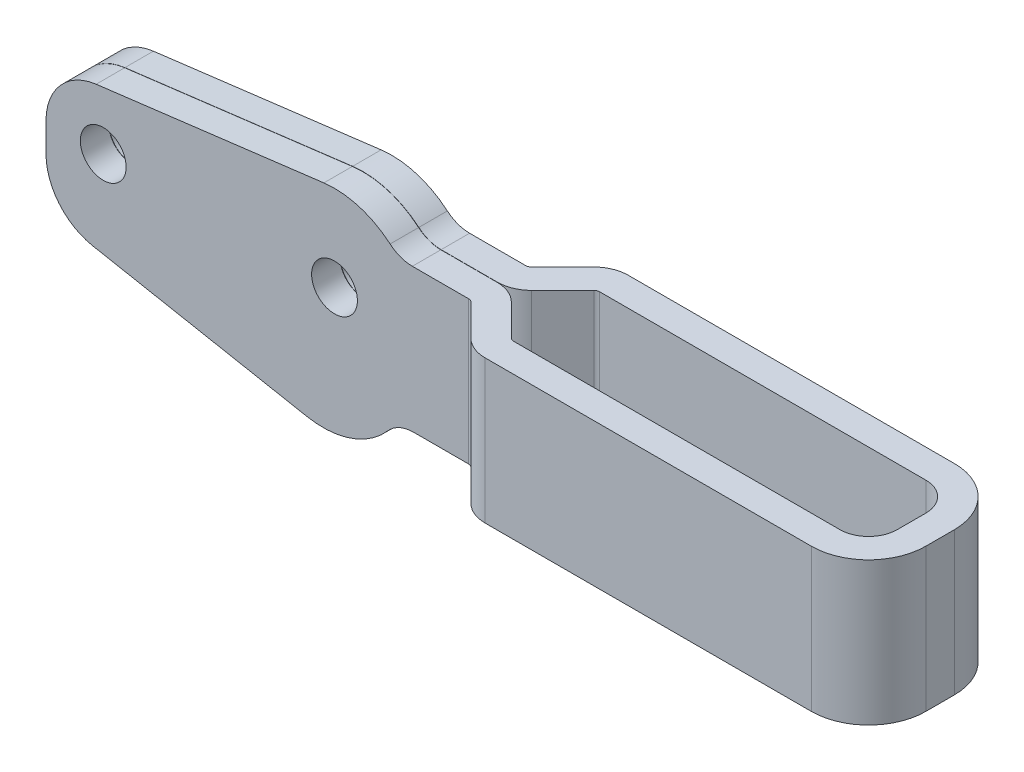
SolidWorks part; units mm, degrees
ref_plane "Plane1" through (0, 0, 0) normal (0, 0, 1) x (1, 0, 0)
ref_plane "Plane2" through (0, 0, 0) normal (0, 1, 0) x (-1, 0, 0)
ref_plane "Plane3" through (0, 0, 0) normal (1, 0, 0) x (0, 0, -1)
sketch "Sketch1" plane through (0, 0, 0) normal (0, 0, 1) x (1, 0, 0)
  line L0 (0, 0) -> (96.012, 0)
  line L1 (0, 0) -> (0, 15.875)
  line L2 (96.012, 15.875) -> (0, 15.875)
  line L3 (96.012, 15.875) -> (96.012, 0)
  dimension "D1" = 96.012
  dimension "D2" = 15.875
extrude "Base-Extrude" add sketch "Sketch1" along normal mid plane 15.875
sketch "Sketch3" plane through (0, 15.875, 0) normal (0, 1, 0) x (-1, 0, 0)
  line L0 (-53.213, -4.7625) -> (-92.837, -4.7625)
  line L1 (0, 0) -> (-68.2806, 0) construction
  line L2 (-92.837, 4.7625) -> (-53.213, 4.7625)
  line L3 (-92.837, 4.7625) -> (-92.837, -4.7625)
  line L4 (-96.012, -7.9375) -> (0, -7.9375) construction
  line L5 (-96.012, 7.9375) -> (-96.012, -7.9375) construction
  line L6 (-96.012, 7.9375) -> (0, 7.9375) construction
  line L7 (2.1181, -3.175) -> (-47.1354, -3.175)
  line L8 (-53.213, -4.7625) -> (-48.4505, 0)
  line L9 (-48.4505, 0) -> (-53.213, 4.7625)
  line L10 (2.1181, 3.175) -> (-47.1354, 3.175)
  line L11 (-47.1354, -3.175) -> (-55.8484, -11.888)
  line L12 (-47.1354, 3.175) -> (-55.8484, 11.888)
  line L13 (-55.8484, -11.888) -> (2.1181, -11.888)
  line L14 (-55.8484, 11.888) -> (2.1181, 11.888)
  line L15 (2.1181, -11.888) -> (2.1181, -3.175)
  line L16 (2.1181, 11.888) -> (2.1181, 3.175)
extrude "Cut-Extrude1" cut sketch "Sketch3" against normal through all
fillet "Fillet5" radius 0.635 4 edges at (53.213, 7.9375, -4.7625) (53.213, 7.9375, 4.7625) (47.1354, 7.9375, 3.175) (47.1354, 7.9375, -3.175)
fillet "Fillet6" radius 3.81 2 edges at (51.8979, 7.9375, 7.9375) (51.8979, 7.9375, -7.9375)
fillet "Fillet7" radius 3.175 2 edges at (92.837, 7.9375, -4.7625) (92.837, 7.9375, 4.7625)
fillet "Fillet8" radius 6.35 2 edges at (96.012, 7.9375, 7.9375) (96.012, 7.9375, -7.9375)
fillet "Fillet9" radius 6.35 1 edges at (0, 15.875, 0)
fillet "Fillet10" radius 6.35 1 edges at (0, 0, 0)
sketch "Sketch6" plane through (0, 0, 3.175) normal (0, 0, 1) x (1, 0, 0)
  line L0 (6.35, 15.875) -> (46.8723, 15.875) construction
  line L1 (7.6318, 9.525) -> (42.545, 9.525) construction
  line L2 (0, 6.35) -> (0, 9.525) construction
  line L3 (38.862, 36.1043) -> (38.862, -14.5143) construction
  line L4 (96.012, 15.875) -> (96.012, 0) construction
  line L5 (5.5641, 15.8262) -> (30.8252, 18.9768)
  line L7 (29.4622, 19.05) -> (53.4108, 19.05) construction
  line L8 (28.2376, -4.572) -> (39.9397, -4.572) construction
  line L9 (5.1654, 0.1115) -> (28.9491, -4.4048)
  line L10 (0, 6.35) -> (0, 9.525)
  arc A0 (6.35, 15.875) -> (0, 9.525) centre (6.35, 9.525) ccw construction
  arc A2 (40.249, 4.7558) -> (30.8252, 18.9768) centre (32.004, 9.525) ccw
  arc A3 (5.5641, 15.8262) -> (0, 9.525) centre (6.35, 9.525) ccw
  arc A4 (40.249, 4.7558) -> (28.9491, -4.4048) centre (30.7261, 4.953) cw
  arc A5 (0, 6.35) -> (6.35, 0) centre (6.35, 6.35) ccw construction
  arc A6 (0, 6.35) -> (5.1654, 0.1115) centre (6.35, 6.35) ccw
  dimension "D1" = 19.05
  dimension "D4" = 24.4161
  dimension "D5" = 9.525
  dimension "D2" = 57.15
  dimension "D3" = 25.654
  dimension "D6" = 23.622
  dimension "D7" = 6.35
extrude "Boss-Extrude3" add sketch "Sketch6" against normal up to surface (6.35 mm away)
fillet "Fillet11" radius 3.81 2 edges at (38.862, 0, 0) (39.1035, 15.875, 0)
sketch "Sketch7" plane through (0, 0, 3.175) normal (0, 0, 1) x (1, 0, 0)
  circle A0 centre (6.35, 9.525) radius 2.54
  circle A1 centre (32.004, 9.525) radius 2.54
  arc A2 (5.5641, 15.8262) -> (0, 9.525) centre (6.35, 9.525) ccw construction
  arc A3 (38.1732, 16.7821) -> (30.8252, 18.9768) centre (32.004, 9.525) ccw construction
  dimension "D1" = 5.08
extrude "Cut-Extrude5" cut sketch "Sketch7" against normal through all
sketch "Sketch8" plane through (0, 15.875, 0) normal (0, 1, 0) x (-1, 0, 0)
  line L0 (0, 0) -> (-59.8442, 0) construction
  line L1 (-53.476, -4.7625) -> (-53.476, 5.9871) construction
  line L2 (3.175, 0.0127) -> (-53.476, 0.0127)
  line L3 (3.175, 0.0127) -> (3.175, -0.0127)
  line L4 (-53.476, -0.0127) -> (3.175, -0.0127)
  line L5 (-53.476, -0.0127) -> (-53.476, 0.0127)
  line L6 (0, 3.175) -> (0, -3.175) construction
  dimension "D1" = 3.175
  dimension "D2" = 0.0127
  dimension "D3" = 0.0254
extrude "Cut-Extrude6" cut sketch "Sketch8" against normal through all and the other way through all
fillet "Fillet12" radius 3.81 1 edges at (48.4632, 7.9375, 0.0127)
fillet "Fillet13" radius 3.81 1 edges at (48.4632, 7.9375, -0.0127)
equation "\"D2@Sketch3\" = \"D3@Sketch3\""
equation "\"D4@Sketch3\" = \"D2@Sketch3\""
equation "\"D6@Sketch3\" = \"D2@Sketch3\""
equation "\"D7@Sketch3\" = \"D2@Sketch3\""
